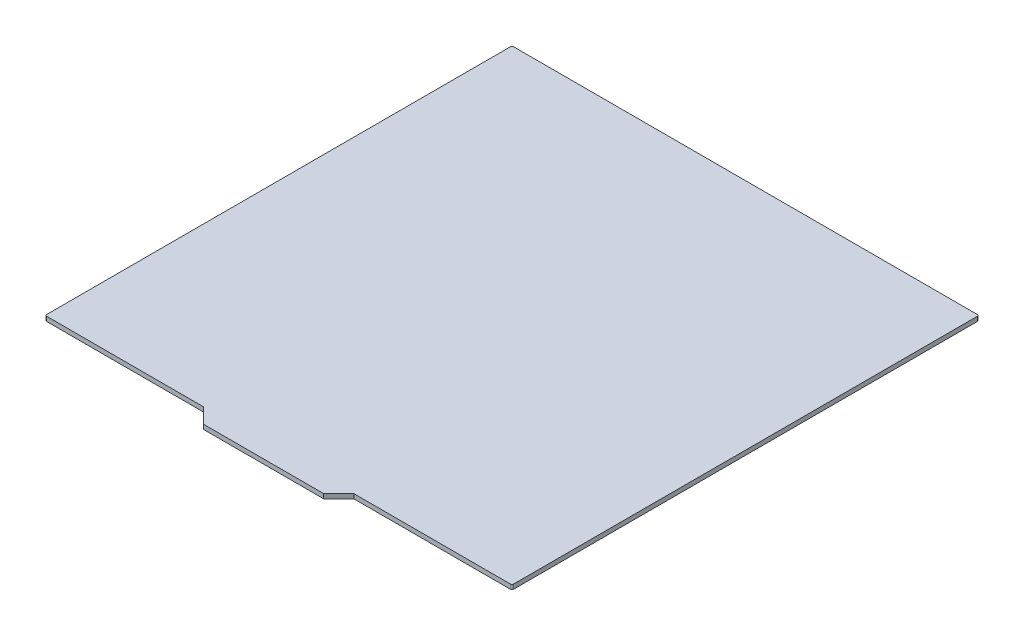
SolidWorks part; units mm, degrees
ref_plane "Ebene vorne" through (0, 0, 0) normal (0, 0, 1) x (1, 0, 0)
ref_plane "Ebene oben" through (0, 0, 0) normal (0, 1, 0) x (1, 0, 0)
ref_plane "Ebene rechts" through (0, 0, 0) normal (1, 0, 0) x (0, 0, -1)
sketch "Skizze1" plane through (0, 0, 0) normal (0, 1, 0) x (1, 0, 0)
  line L0 (-50, -155) -> (-40, -165)
  line L1 (-155, -155) -> (-50, -155)
  line L2 (-155, -155) -> (-155, 155)
  line L3 (-155, 155) -> (155, 155)
  line L4 (155, -155) -> (155, 155)
  line L5 (-155, -155) -> (155, 155) construction
  line L6 (-155, 155) -> (155, -155) construction
  line L7 (-40, -165) -> (40, -165)
  line L8 (40, -165) -> (50, -155)
  line L9 (50, -155) -> (155, -155)
  point P0 (0, 0)
  dimension "D1" = 310
  dimension "D2" = 310
  dimension "D3" = 10
  dimension "D4" = 45
  dimension "D5" = 100
extrude "Aufsatz-Linear austragen1" add sketch "Skizze1" along normal blind 3
fillet "Verrundung1" radius 1 4 edges at (-155, 1.5, 155) (-155, 1.5, -155) (155, 1.5, -155) (155, 1.5, 155)
